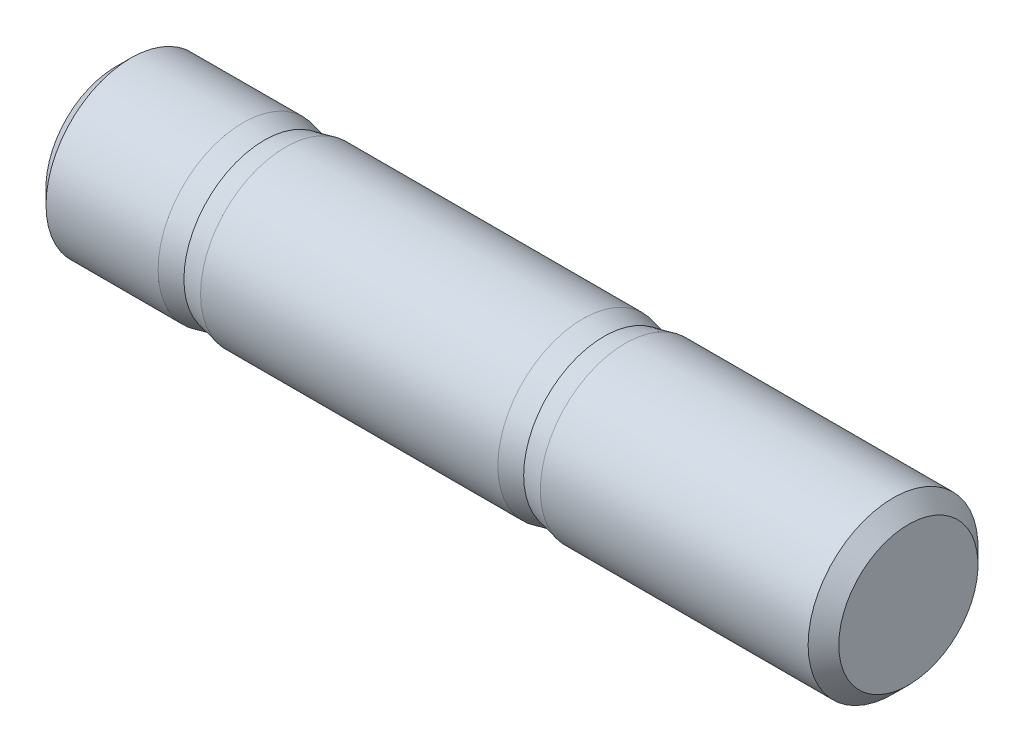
SolidWorks part; units mm, degrees
ref_plane "Front" through (0, 0, 0) normal (0, 0, 1) x (1, 0, 0)
ref_plane "Top" through (0, 0, 0) normal (0, 1, 0) x (1, 0, 0)
ref_plane "Right" through (0, 0, 0) normal (1, 0, 0) x (0, 0, -1)
sketch "Sketch1" plane through (0, 0, 0) normal (0, 0, 1) x (1, 0, 0)
  line L0 (-1.3108, 0) -> (30.3862, 0) construction
  line L1 (0, 0) -> (0, 3)
  line L2 (0, 3) -> (4.5, 3)
  line L3 (4.5, 3) -> (6, 2.675)
  line L4 (6, 2.675) -> (16.5, 2.675)
  line L5 (16.5, 2.675) -> (18, 3)
  line L6 (18, 3) -> (28, 3)
  line L7 (28, 3) -> (28, 0)
  line L8 (28, 0) -> (0, 0)
  dimension "X" = 1.5
  dimension "D2" = 1.5
  dimension "bm" = 6
  dimension "b" = 10
  dimension "l" = 22
  dimension "d" = 6
  dimension "ds" = 5.35
revolve "BaseHead" add sketch "Sketch1" angle 360 about L0
chamfer "HeadChamfer" distance 0.5415 angle 45 2 edges at (0, 0, 3) (28, 0, 3)
sketch "Sketch2" plane through (0, 0, 0) normal (0, 0, 1) x (1, 0, 0)
  line L0 (4.9774, 0) -> (31.2107, 0) construction
  line L2 (4.5, 2.675) -> (6, 3)
  line L3 (6, 3) -> (16.5, 3)
  line L4 (16.5, 3) -> (18, 2.675)
  line L7 (-1.3108, 0) -> (30.3862, 0) construction
  line L9 (4.5, 2.675) -> (18, 2.675)
  line L10 (18, 3) -> (18, -3) construction
  line L11 (4.5, 3) -> (4.5, -3) construction
  dimension "D1" = 1.5
  dimension "D2" = 6
revolve "BaseBody" add sketch "Sketch2" angle 360 about L0
sketch "Sketch3" plane through (0, 0, 0) normal (0, 0, 1) x (1, 0, 0)
  line L0 (27.4585, 2.531) -> (27.7293, 3)
  line L1 (27.7293, 3) -> (27.7293, 3.5)
  line L2 (27.7293, 3.5) -> (27.1878, 3.5)
  line L3 (27.1878, 3.5) -> (27.1878, 3)
  line L4 (27.1878, 3) -> (27.4585, 2.531)
  line L5 (0, 0) -> (34.9578, 0) construction
  line L6 (27.4585, 3) -> (27.4585, -3) construction
  dimension "D1" = 60
  dimension "D2" = 60
  dimension "D3" = 0.5415
  dimension "D4" = 0.5
  dimension "D5" = 6
revolve "Cut-Revolve10" [suppressed] cut sketch "Sketch3" angle 360 about L5
pattern_linear "LPattern10" [suppressed] count 15 spacing 0.6498 along (1, 0, 0)
sketch "Sketch4" plane through (0, 0, 0) normal (0, 0, 1) x (1, 0, 0)
  line L0 (0.5415, 2.531) -> (0.8123, 3)
  line L1 (0.8123, 3) -> (0.8123, 3.5)
  line L2 (0.8123, 3.5) -> (0.2708, 3.5)
  line L3 (0.2708, 3.5) -> (0.2708, 3)
  line L4 (0.2708, 3) -> (0.5415, 2.531)
  line L5 (0, 0) -> (3.2691, 0) construction
  line L6 (0.5415, 3) -> (0.5415, -3) construction
  dimension "D1" = 60
  dimension "D2" = 0.5415
  dimension "D3" = 0.5
  dimension "D4" = 60
  dimension "D5" = 6
revolve "Cut-Revolve11" [suppressed] cut sketch "Sketch4" angle 360 about L5
pattern_linear "LPattern11" [suppressed] count 7 spacing 0.6498 along (1, 0, 0)
equation "\"D2@Sketch1\" = \"X@Sketch1\""
equation "\"D2@ThreadCosmetic2\" = \"D2@ThreadCosmetic1\""
equation "\"D1@ThreadCosmetic1\" = \"bm@Sketch1\"-\"X@Sketch1\""
equation "\"b@ThreadCosmetic2\" = \"b@Sketch1\""
equation "\"D1@Sketch2\" = \"X@Sketch1\""
equation "\"D2@Sketch2\" = \"d@Sketch1\""
equation "\"D1@HeadChamfer\" =  ( \"d@Sketch1\" - \"D2@ThreadCosmetic1\" )  / 2"
equation "\"D5@Sketch3\" = \"d@Sketch1\""
equation "\"D3@Sketch3\" =  ( \"d@Sketch1\" - \"D2@ThreadCosmetic2\" )  / 2"
equation "\"D3@LPattern10\" = \"D3@Sketch3\" * 1.2"
equation "\"D1@LPattern10\" = \"b@ThreadCosmetic2\" / \"D3@LPattern10\""
equation "\"D5@Sketch4\" = \"d@Sketch1\""
equation "\"D2@Sketch4\" =  ( \"d@Sketch1\" - \"D2@ThreadCosmetic1\" )  / 2"
equation "\"D3@LPattern11\" = \"D2@Sketch4\" * 1.2"
equation "\"D1@LPattern11\" = \"D1@ThreadCosmetic1\" / \"D3@LPattern11\""
